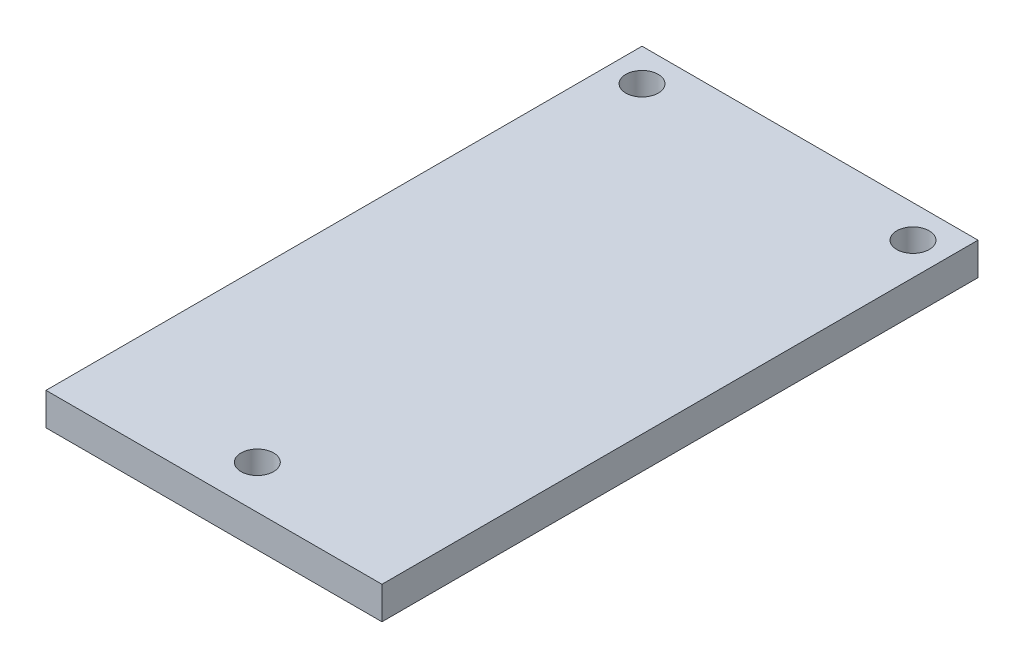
SolidWorks part; units mm, degrees
ref_plane "Front" through (0, 0, 0) normal (0, 0, 1) x (1, 0, 0)
ref_plane "Top" through (0, 0, 0) normal (0, 1, 0) x (1, 0, 0)
ref_plane "Right" through (0, 0, 0) normal (1, 0, 0) x (0, 0, -1)
sketch "Sketch1" plane through (0, 0, 0) normal (0, 1, 0) x (1, 0, 0)
  line L1 (0, 0) -> (62, 0)
  line L2 (0, 0) -> (0, 110)
  line L3 (0, 110) -> (62, 110)
  line L4 (62, 0) -> (62, 110)
  circle A0 centre (31, 8) radius 3
  circle A1 centre (6, 104) radius 3
  circle A2 centre (56, 104) radius 3
extrude "Extrude1" add sketch "Sketch1" along normal blind 6
